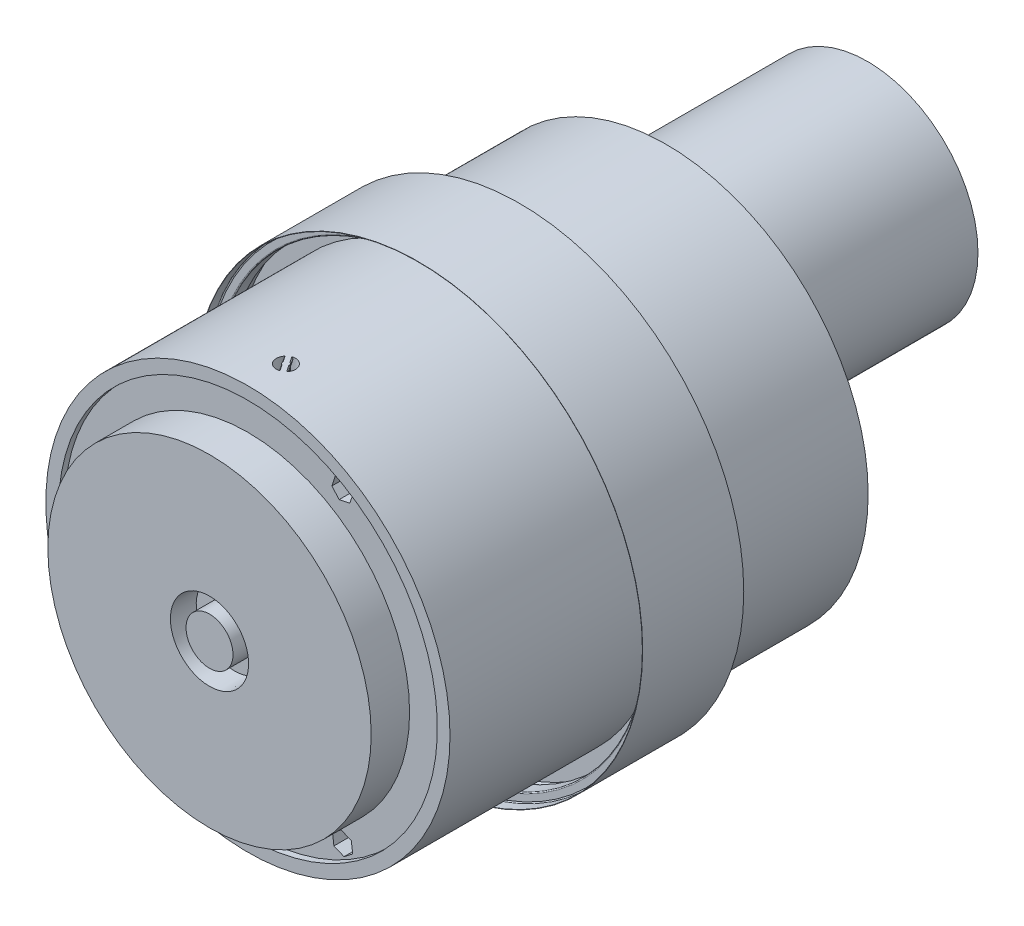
SolidWorks part; units mm, degrees
ref_plane "Front" through (0, 0, 0) normal (0, 0, 1) x (1, 0, 0)
ref_plane "Top" through (0, 0, 0) normal (0, 1, 0) x (1, 0, 0)
ref_plane "Right" through (0, 0, 0) normal (1, 0, 0) x (0, 0, -1)
sketch "Sketch2" plane through (0, 0, 0) normal (0, 0, 1) x (1, 0, 0)
  circle A0 centre (15.748, 0) radius 56.3563 construction
  circle A1 centre (15.748, 0) radius 56.3563
extrude "Base-Extrude" add sketch "Sketch2" against normal up to surface (128.6002 mm away)
other "Cavity1"
other "ASSEMBLY, THRUSTER CONE<1>@CONE ASSEMBLY/CONE<1>@ASSEMBLY, THRUSTER CONE"
sketch "Sketch3" plane through (0, 0, 0) normal (0, 0, 1) x (1, 0, 0)
  circle A0 centre (15.748, 0) radius 50.8 construction
  circle A1 centre (15.748, 0) radius 50.8
extrude "Boss-Extrude1" add sketch "Sketch3" along normal up to surface (52.5272 mm away)
other "Cavity4"
other "MOTOR HOUSING<1>@CONE ASSEMBLY"
other "Cavity2"
other "MOTOR HOUSING INTERNAL BRACKET<2>@CONE ASSEMBLY"
other "SCREW, SKT HD CAP, .138-32UNC-2A X .50L<2>@CONE ASSEMBLY"
other "ASSEMBLY, THRUSTER CONE<1>@CONE ASSEMBLY/YARDLEY INSERT<26>@ASSEMBLY, THRUSTER CONE"
other "ASSEMBLY, THRUSTER CONE<1>@CONE ASSEMBLY/YARDLEY INSERT<25>@ASSEMBLY, THRUSTER CONE"
other "ASSEMBLY, THRUSTER CONE<1>@CONE ASSEMBLY/YARDLEY INSERT<24>@ASSEMBLY, THRUSTER CONE"
other "ASSEMBLY, THRUSTER CONE<1>@CONE ASSEMBLY/YARDLEY INSERT<23>@ASSEMBLY, THRUSTER CONE"
other "ASSEMBLY, THRUSTER CONE<1>@CONE ASSEMBLY/YARDLEY INSERT<12>@ASSEMBLY, THRUSTER CONE"
other "ASSEMBLY, THRUSTER CONE<1>@CONE ASSEMBLY/YARDLEY INSERT<11>@ASSEMBLY, THRUSTER CONE"
other "ASSEMBLY, THRUSTER CONE<1>@CONE ASSEMBLY/YARDLEY INSERT<10>@ASSEMBLY, THRUSTER CONE"
other "ASSEMBLY, THRUSTER CONE<1>@CONE ASSEMBLY/YARDLEY INSERT<9>@ASSEMBLY, THRUSTER CONE"
other "ASSEMBLY, THRUSTER CONE<1>@CONE ASSEMBLY/YARDLEY INSERT<8>@ASSEMBLY, THRUSTER CONE"
other "ASSEMBLY, THRUSTER CONE<1>@CONE ASSEMBLY/YARDLEY INSERT<7>@ASSEMBLY, THRUSTER CONE"
other "ASSEMBLY, THRUSTER CONE<1>@CONE ASSEMBLY/YARDLEY INSERT<6>@ASSEMBLY, THRUSTER CONE"
other "ASSEMBLY, THRUSTER CONE<1>@CONE ASSEMBLY/YARDLEY INSERT<5>@ASSEMBLY, THRUSTER CONE"
other "ASSEMBLY, THRUSTER CONE<1>@CONE ASSEMBLY/YARDLEY INSERT<4>@ASSEMBLY, THRUSTER CONE"
other "ASSEMBLY, THRUSTER CONE<1>@CONE ASSEMBLY/YARDLEY INSERT<3>@ASSEMBLY, THRUSTER CONE"
other "ASSEMBLY, THRUSTER CONE<1>@CONE ASSEMBLY/YARDLEY INSERT<2>@ASSEMBLY, THRUSTER CONE"
other "ASSEMBLY, THRUSTER CONE<1>@CONE ASSEMBLY/YARDLEY INSERT<1>@ASSEMBLY, THRUSTER CONE"
other "SEAL HOUSING<1>@CONE ASSEMBLY"
other "DRIVETRAIN<1>@CONE ASSEMBLY/SCREW, SKT HD CAP, .164-32UNC-2A X .50L<4>@DRIVETRAIN"
other "DRIVETRAIN<1>@CONE ASSEMBLY/SCREW, SKT HD CAP, .164-32UNC-2A X .50L<3>@DRIVETRAIN"
other "DRIVETRAIN<1>@CONE ASSEMBLY/SCREW, SKT HD CAP, .164-32UNC-2A X .50L<2>@DRIVETRAIN"
other "DRIVETRAIN<1>@CONE ASSEMBLY/SCREW, SKT HD CAP, .164-32UNC-2A X .50L<1>@DRIVETRAIN"
other "DRIVETRAIN<1>@CONE ASSEMBLY/GEARHEAD<1>@DRIVETRAIN"
other "DRIVETRAIN<1>@CONE ASSEMBLY/MOTOR<1>@DRIVETRAIN"
other "DRIVETRAIN<1>@CONE ASSEMBLY/ADAPTOR PLATE<1>@DRIVETRAIN"
other "Cavity3"
other "WASHER, LOCK, HELICAL, .136 NOM<7>@CONE ASSEMBLY"
other "SCREW, SKT HD CAP, .138-32UNC-2A X .50L<7>@CONE ASSEMBLY"
other "WASHER, LOCK, HELICAL, .136 NOM<6>@CONE ASSEMBLY"
other "WASHER, LOCK, HELICAL, .136 NOM<4>@CONE ASSEMBLY"
other "WASHER, LOCK, HELICAL, .136 NOM<3>@CONE ASSEMBLY"
other "SCREW, SKT HD CAP, .138-32UNC-2A X .50L<6>@CONE ASSEMBLY"
other "SCREW, SKT HD CAP, .138-32UNC-2A X .50L<4>@CONE ASSEMBLY"
other "SCREW, SKT HD CAP, .138-32UNC-2A X .50L<3>@CONE ASSEMBLY"
other "SOCKET HEAD CAP SCREWS (U.S.)<25>@CONE ASSEMBLY"
other "SOCKET HEAD CAP SCREWS (U.S.)<24>@CONE ASSEMBLY"
other "SOCKET HEAD CAP SCREWS (U.S.)<23>@CONE ASSEMBLY"
other "SOCKET HEAD CAP SCREWS (U.S.)<22>@CONE ASSEMBLY"
other "SOCKET HEAD CAP SCREWS (U.S.)<21>@CONE ASSEMBLY"
other "Cavity5"
other "BLEED SCREW<1>@CONE ASSEMBLY"
other "SOCKET HEAD CAP SCREWS (U.S.)<17>@CONE ASSEMBLY"
other "SOCKET HEAD CAP SCREWS (U.S.)<16>@CONE ASSEMBLY"
other "MALE-FEMALE HEX STANDOFF<2>@CONE ASSEMBLY"
other "MALE-FEMALE HEX STANDOFF<1>@CONE ASSEMBLY"
other "NPT TO BARBED FITTING<1>@CONE ASSEMBLY"
other "PC Board, Motor Housing<1>@CONE ASSEMBLY"
